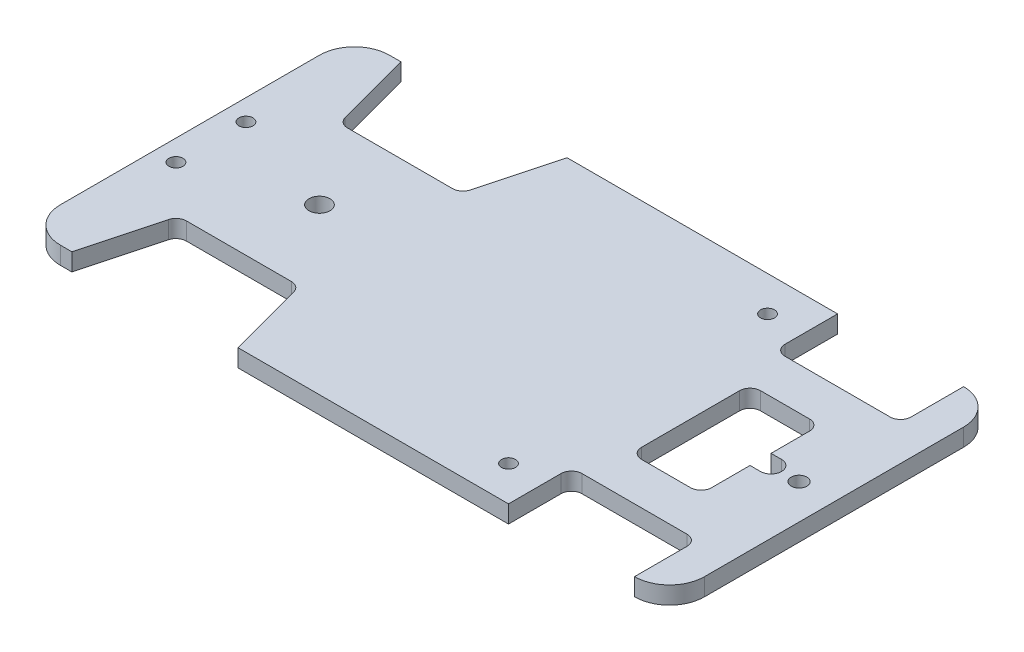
SolidWorks part; units mm, degrees
ref_plane "Front Plane" through (0, 0, 0) normal (0, 0, 1) x (1, 0, 0)
ref_plane "Top Plane" through (0, 0, 0) normal (0, 1, 0) x (1, 0, 0)
ref_plane "Right Plane" through (0, 0, 0) normal (1, 0, 0) x (0, 0, -1)
sketch "Sketch1" plane through (0, 0, 0) normal (0, 1, 0) x (1, 0, 0)
  line L0 (0, 0) -> (184, 0) construction
  line L1 (0, -37) -> (0, 37)
  line L2 (10, 47) -> (13.2672, 47)
  line L3 (13.2672, 47) -> (19.1022, 25.2235)
  line L4 (22, 23) -> (52, 23)
  line L5 (54.8978, 25.2235) -> (60.7328, 47)
  line L6 (60.7328, 47) -> (138, 47)
  line L7 (138, 47) -> (138, 32)
  line L8 (141, 29) -> (171, 29)
  line L9 (174, 32) -> (174, 47)
  line L10 (166, 3) -> (163, 3)
  line L11 (184, 37) -> (184, -37)
  line L12 (174, 37) -> (184, 37) construction
  line L13 (163, 3) -> (163, 14)
  line L14 (160, 17) -> (146, 17)
  line L15 (143, 14) -> (143, -14)
  line L16 (10, -47) -> (13.2672, -47)
  line L17 (13.2672, -47) -> (19.1022, -25.2235)
  line L18 (22, -23) -> (52, -23)
  line L19 (54.8978, -25.2235) -> (60.7328, -47)
  line L20 (60.7328, -47) -> (138, -47)
  line L21 (138, -47) -> (138, -32)
  line L22 (141, -29) -> (171, -29)
  line L23 (174, -32) -> (174, -47)
  line L24 (160, -17) -> (146, -17)
  line L25 (163, -3) -> (163, -14)
  line L26 (166, -3) -> (163, -3)
  arc A0 (22, 23) -> (19.1022, 25.2235) centre (22, 26) cw
  arc A1 (52, 23) -> (54.8978, 25.2235) centre (52, 26) ccw
  arc A2 (141, 29) -> (138, 32) centre (141, 32) cw
  arc A3 (174, 32) -> (171, 29) centre (171, 32) cw
  arc A4 (0, 37) -> (10, 47) centre (10, 37) cw
  arc A5 (184, 37) -> (174, 47) centre (174, 37) ccw
  circle A6 centre (174, 0) radius 2.25
  circle A7 centre (37, 0) radius 3
  circle A8 centre (6, 10) radius 2
  arc A9 (166, -3) -> (166, 3) centre (166, 0) ccw
  arc A10 (143, 14) -> (146, 17) centre (146, 14) cw
  arc A11 (163, 14) -> (160, 17) centre (160, 14) ccw
  arc A12 (0, -37) -> (10, -47) centre (10, -37) ccw
  arc A13 (22, -23) -> (19.1022, -25.2235) centre (22, -26) ccw
  arc A14 (52, -23) -> (54.8978, -25.2235) centre (52, -26) cw
  arc A15 (141, -29) -> (138, -32) centre (141, -32) ccw
  arc A16 (174, -32) -> (171, -29) centre (171, -32) ccw
  arc A17 (184, -37) -> (174, -47) centre (174, -37) cw
  arc A18 (143, -14) -> (146, -17) centre (146, -14) ccw
  arc A19 (163, -14) -> (160, -17) centre (160, -14) cw
  circle A20 centre (6, -10) radius 2
  circle A21 centre (128, 37) radius 2
  circle A22 centre (128, -37) radius 2
  point P39 (143, 17)
  point P42 (163, 17)
  point P65 (143, 0)
  dimension "D9" = 3
  dimension "D13" = 10
  dimension "D15" = 4.5
  dimension "D16" = 10
  dimension "D17" = 6
  dimension "D18" = 37
  dimension "D19" = 10
  dimension "D20" = 6
  dimension "D21" = 4
  dimension "D22" = 3
  dimension "D23" = 23
  dimension "D27" = 3
  dimension "D28" = 4
  dimension "D29" = 10
  dimension "D30" = 10
  dimension "D1" = 184
  dimension "D2" = 10
  dimension "D3" = 36
  dimension "D4" = 18
  dimension "D5" = 47
  dimension "D6" = 24
  dimension "D7" = 75
  dimension "D8" = 75
  dimension "D10" = 22
  dimension "D11" = 30
  dimension "D12" = 86
  dimension "D14" = 24
  dimension "D24" = 20
  dimension "D25" = 17
  dimension "D26" = 21
extrude "Extrude1" add sketch "Sketch1" along normal blind 5
